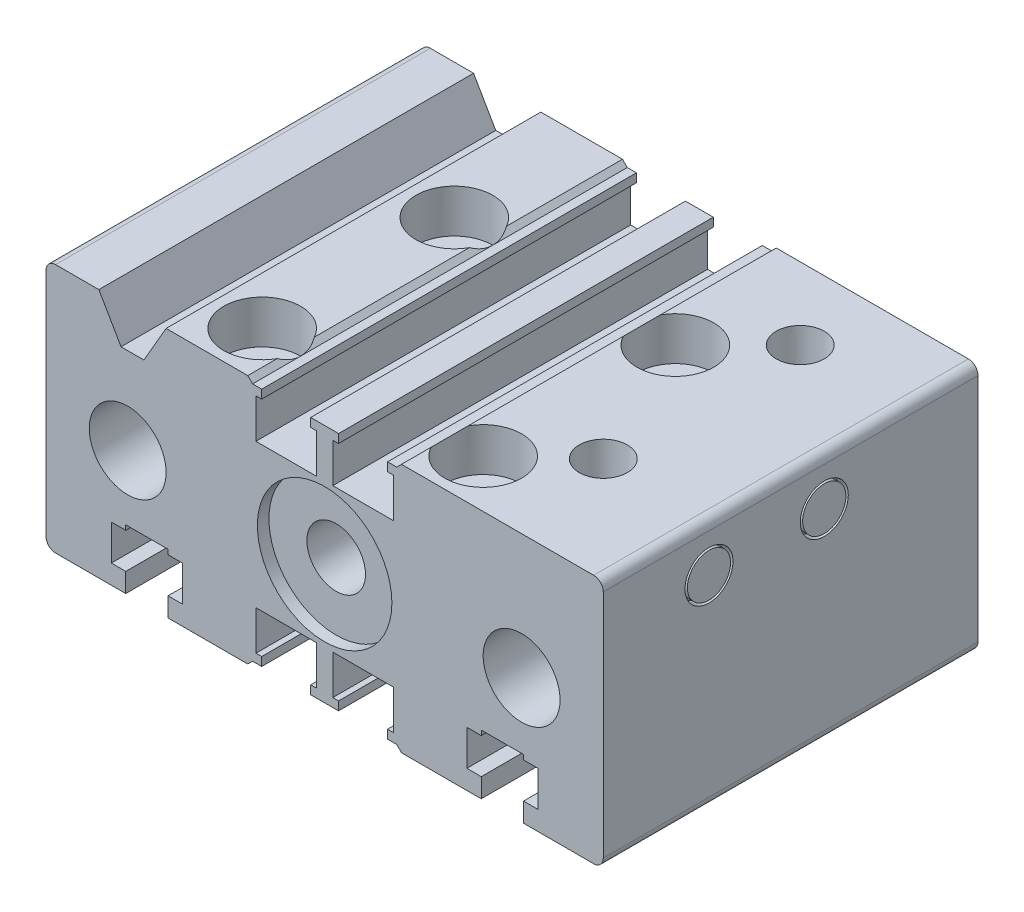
SolidWorks part; units mm, degrees
ref_plane "Plane1" through (0, 0, 0) normal (0, 0, 1) x (1, 0, 0)
ref_plane "Plane2" through (0, 0, 0) normal (0, 1, 0) x (1, 0, 0)
ref_plane "Plane3" through (0, 0, 0) normal (1, 0, 0) x (0, 0, -1)
sketch "Sketch1" plane through (0, 0, 0) normal (0, 0, 1) x (1, 0, 0)
  line L0 (0, 0) -> (0, 30.5092) construction
  line L1 (0, 0) -> (36.9322, 0) construction
  line L3 (-29, 13) -> (29, 13)
  line L4 (-29, 13) -> (-29, -13)
  line L5 (-29, -13) -> (29, -13)
  line L6 (29, 13) -> (29, -13)
  dimension "D1" = 58
  dimension "J" = 13
  dimension "K" = 13
extrude "Base-Extrude" add sketch "Sketch1" along normal up to surface and the other way up to surface
ref_plane "MidPlane" through (0, 0, 0) normal (0, 1, 0) x (-1, 0, 0)
sketch "Sketch9" plane through (0, 0, 19.5) normal (0, 0, 1) x (1, 0, 0)
  circle A0 centre (0, 0) radius 45.5
  dimension "D1" = 91
extrude "Boss_80_100" add sketch "Sketch9" against normal up to surface (108 mm away)
sketch "Sketch10" plane through (0, 0, 54) normal (0, 0, 1) x (1, 0, 0)
  line L0 (76, 35) -> (43.0726, 35)
  line L1 (40.5478, -37.8963) -> (51, -56)
  line L2 (-40.5478, -37.8963) -> (-51, -56)
  line L3 (120, 45) -> (32.4846, 45) construction
  line L4 (0, -20) -> (0, 0) construction
  line L5 (-43.0726, 35) -> (-92.2265, 35)
  line L6 (-32.4846, 45) -> (-120, 45) construction
  line L7 (76, 45) -> (32.4846, 45)
  line L8 (-32.4846, 45) -> (-98, 45)
  line L9 (-51, -56) -> (51, -56)
  line L10 (-120, -56) -> (120, -56) construction
  line L11 (-98, 45) -> (-92.2265, 35)
  line L12 (76, 35) -> (76, 45)
  arc A0 (43.0726, 35) -> (32.4846, 45) centre (0, 0) ccw
  arc A2 (32.4846, 45) -> (-32.4846, 45) centre (0, 0) ccw construction
  arc A3 (-40.5478, -37.8963) -> (40.5478, -37.8963) centre (0, 0) ccw
  arc A4 (-32.4846, 45) -> (-43.0726, 35) centre (0, 0) ccw
  point P11 (0, 60)
  dimension "D3" = 84
  dimension "D1" = 61
  dimension "D2" = 85
  dimension "D4" = 30
  dimension "D6" = 30
  dimension "D7" = 10
extrude "Cut-Extrude1" cut sketch "Sketch10" against normal through all
sketch "Sketch12"
  line L0 (0, 0) -> (0, 89.8309) construction
  line L1 (-92.2265, 35) -> (-43.0726, 35) construction
  line L3 (-49.1625, 35) -> (-43.0726, 35)
  arc A0 (0, 55.5) -> (-49.1625, 35) centre (0, -13.7) ccw
  arc A1 (43.0726, 35) -> (-43.0726, 35) centre (0, 0) ccw construction
  arc A2 (0, 55.5) -> (-43.0726, 35) centre (0, 0) ccw
  point P0 (0, 13.7)
  point P1 (0, -13.7)
  point P10 (0, 0)
  dimension "D3" = 138.4
  dimension "D1" = 13.7
  dimension "D2" = 13.7
fillet "Fillet1" radius 1 4 edges at (-29, -13, 0) (29, -13, 0) (29, 13, 0) (-29, 13, 0)
extrude "T-Grooves" cut sketch "Sketch5" against normal through all
sketch "Sketch5" plane through (0, 0, 19.5) normal (0, 0, 1) x (1, 0, 0)
  line L0 (-18.5, -24) -> (-18.5, -8.6831) construction
  line L1 (-29, -13) -> (29, -13) construction
  line L2 (-20.7, -13) -> (-20.7, -11)
  line L3 (-16.3, -13) -> (-16.3, -11)
  line L4 (-20.7, -11) -> (-22.2, -11)
  line L5 (-16.3, -11) -> (-14.8, -11)
  line L6 (-22.2, -11) -> (-22.2, -7.3)
  line L7 (-14.8, -11) -> (-14.8, -7.3)
  line L8 (-22.2, -7.3) -> (-20.7, -7.3)
  line L9 (-14.8, -7.3) -> (-16.3, -7.3)
  line L10 (-20.7, -7.3) -> (-20.7, -6.8)
  line L11 (-16.3, -7.3) -> (-16.3, -6.8)
  line L12 (-20.7, -6.8) -> (-16.3, -6.8)
  line L13 (0, 0) -> (0, -16.4707) construction
  line L14 (20.7, -6.8) -> (16.3, -6.8)
  line L16 (16.3, -7.3) -> (16.3, -6.8)
  line L17 (20.7, -7.3) -> (20.7, -6.8)
  line L18 (14.8, -7.3) -> (16.3, -7.3)
  line L19 (22.2, -7.3) -> (20.7, -7.3)
  line L20 (14.8, -11) -> (14.8, -7.3)
  line L21 (22.2, -11) -> (22.2, -7.3)
  line L22 (16.3, -11) -> (14.8, -11)
  line L23 (20.7, -11) -> (22.2, -11)
  line L24 (16.3, -13) -> (16.3, -11)
  line L25 (20.7, -13) -> (20.7, -11)
  line L26 (18.5, -11.9621) -> (18.5, -15.8945) construction
  line L27 (16.3, -13) -> (20.7, -13)
  line L28 (-20.7, -13) -> (-16.3, -13)
  dimension "D1" = 4.4
  dimension "D2" = 0.5
  dimension "D3" = 7.4
  dimension "D4" = 3.7
  dimension "D5" = 2
  dimension "D6" = 37
extrude "Boss-Extrude1" add sketch "Sketch12" along normal up to surface (108 mm away)
mirror "Boss-Extrude1 Mirror" about plane through (0, 0, 0) normal (1, 0, 0)
sketch "Sketch11" plane through (0, 0, 19.5) normal (0, 0, 1) x (1, 0, 0)
  line L0 (0, 0) -> (-46.0532, 79.7665) construction
  line L1 (0, 0) -> (0, 89.8309) construction
  line L2 (-22.8069, 22.5028) -> (-45.6801, 62.1202) construction
  line L3 (0, 0) -> (-14.1941, -8.1949) construction
  line L4 (-30.6815, 26.742) -> (-35.6815, 35.4022)
  line L5 (-22.5409, 31.442) -> (-27.5409, 40.1022)
  line L7 (-27.5409, 40.1022) -> (-35.6815, 35.4022)
  line L14 (-30.6815, 26.742) -> (-26.6112, 29.092)
  line L15 (-22.5409, 31.442) -> (-26.6112, 29.092)
  dimension "D1" = 30
  dimension "D2" = 8.5
  dimension "D3" = 9.4
  dimension "D7" = 38.5
  dimension "D8" = 10
extrude "SwitchGrooveBoss" add sketch "Sketch11" along normal up to surface (108 mm away)
sketch "Sketch13" plane through (0, 0, 54) normal (0, 0, 1) x (1, 0, 0)
  line L0 (-37.4612, 47.8847) -> (-33.1368, 40.3947) construction
  line L1 (-33.3909, 50.2347) -> (-41.5315, 45.5347) construction
  line L2 (-31.925, 47.6957) -> (-33.3909, 50.2347) construction
  line L3 (-41.5315, 45.5347) -> (-39.9533, 42.8011) construction
  line L4 (-39.5392, 45.1839) -> (-37.6892, 41.9796)
  line L5 (-34.0832, 48.3339) -> (-32.2332, 45.1296)
  line L6 (-37.6892, 41.9796) -> (-34.9612, 43.5546)
  line L7 (-32.2332, 45.1296) -> (-34.9612, 43.5546)
  line L8 (-39.5392, 45.1839) -> (-38.9763, 45.5089)
  line L9 (-34.0832, 48.3339) -> (-34.6462, 48.0089)
  line L10 (-38.9763, 45.5089) -> (-39.6263, 46.6347)
  line L11 (-34.6462, 48.0089) -> (-35.2962, 49.1347)
  line L12 (-39.6263, 46.6347) -> (-35.2962, 49.1347)
  dimension "D1" = 5
  dimension "D2" = 6.3
  dimension "D3" = 5.1
  dimension "D4" = 4.1
extrude "SwitchGrooveCut" cut sketch "Sketch13" against normal through all
mirror "SwitchGrooveMirror1" about plane through (0, 0, 0) normal (1, 0, 0)
mirror "SwitchGrooveMirror2" about plane through (0, 0, 0) normal (0, 1, 0)
sketch "Sketch6" plane through (0, 0, 19.5) normal (0, 0, 1) x (1, 0, 0)
  line L0 (-4, -13) -> (-4, -9.0947) construction
  line L1 (-16.3, -13) -> (16.3, -13) construction
  line L2 (-6.55, -13) -> (-6.55, -11.6)
  line L3 (-1.45, -13) -> (-1.45, -11.6)
  line L4 (-6.55, -11.6) -> (-7.15, -11.6)
  line L5 (-1.45, -11.6) -> (-0.85, -11.6)
  line L6 (-7.15, -11.6) -> (-7.15, -7.5)
  line L7 (-0.85, -11.6) -> (-0.85, -7.5)
  line L8 (-7.15, -7.5) -> (-0.85, -7.5)
  line L9 (0, 0) -> (0, -15.1958) construction
  line L10 (7.15, -7.5) -> (0.85, -7.5)
  line L11 (0.85, -11.6) -> (0.85, -7.5)
  line L12 (7.15, -11.6) -> (7.15, -7.5)
  line L13 (1.45, -11.6) -> (0.85, -11.6)
  line L14 (6.55, -11.6) -> (7.15, -11.6)
  line L15 (1.45, -13) -> (1.45, -11.6)
  line L16 (6.55, -13) -> (6.55, -11.6)
  line L17 (4, -7.5) -> (4, -15.1958) construction
  line L18 (-6.55, -13) -> (-1.45, -13)
  line L19 (1.45, -13) -> (6.55, -13)
  line L30 (0, 0) -> (0, 17.045) construction
  point P13 (-4, -7.5)
  point P24 (4, -7.5)
  dimension "D4" = 5.5
  dimension "d2" = 6.3
  dimension "D3" = 4.1
  dimension "D6" = 5.1
  dimension "D5" = 8
extrude "SwitchGrooves" cut sketch "Sketch6" against normal through all
mirror "TopSwitchGrooves" about plane through (0, 0, 0) normal (0, 1, 0) of "SwitchGrooves"
sketch "Sketch7" plane through (0, 0, -19.5) normal (0, 0, 1) x (1, 0, 0)
  line L0 (0, 0) -> (0, 19.7119) construction
  line L1 (0, 0) -> (17.3251, 0) construction
  circle A0 centre (25, 9) radius 2
  circle A1 centre (25, -9) radius 2
  circle A2 centre (-25, -9) radius 2
  circle A3 centre (-25, 9) radius 2
  dimension "D1" = 4
  dimension "D2" = 50
  dimension "D3" = 18
extrude "4-thruHoles" cut sketch "Sketch7" along normal blind 10
sketch "Sketch8" plane through (0, 0, 19.5) normal (0, 0, 1) x (1, 0, 0)
  line L0 (0, 0) -> (0, 20.2881) construction
  circle A0 centre (20.5, 0) radius 4
  circle A1 centre (-20.5, 0) radius 4
  dimension "D1" = 8
  dimension "D2" = 41
extrude "GuideRodThruBores" cut sketch "Sketch8" against normal through all
sketch "Sketch2" plane through (0, 0, 0) normal (0, 0, 1) x (1, 0, 0)
  circle A0 centre (0, 0) radius 6
  dimension "D1" = 12
extrude "StrokeChamber" cut sketch "Sketch2" along normal up to surface and the other way up to surface
sketch "Sketch3" plane through (0, 0, 19.5) normal (0, 0, 1) x (1, 0, 0)
  circle A0 centre (0, 0) radius 7
  dimension "D1" = 14
extrude "FrontDetail" cut sketch "Sketch3" against normal blind 1.2
mirror "Mirror1" about plane through (0, 0, 0) normal (0, 0, 1) of "FrontDetail"
sketch "Sketch4" plane through (0, 0, 18.3) normal (0, 0, 1) x (1, 0, 0)
  circle A0 centre (0, 0) radius 3.05
  dimension "D1" = 6.1
extrude "RodThruBore" cut sketch "Sketch4" against normal up to surface (18.3 mm away)
sketch "Sketch14" plane through (0, 13, 0) normal (0, 1, 0) x (-1, 0, 0)
  line L0 (0, 0) -> (0, -116.3953) construction
  line L1 (-28, 19.5) -> (-6.55, 19.5) construction
  line L2 (-6.55, -19.5) -> (-28, -19.5) construction
  circle A0 centre (-18, 8.5) radius 2.5
  circle A1 centre (-18, -12) radius 2.5
  dimension "D2" = 18
  dimension "D3" = 7.5
  dimension "D5" = 11
extrude "Ports" cut sketch "Sketch14" against normal blind 5 draft 3
ref_plane "ThruHole&CborePlane" through (0, 13, 0) normal (0, 1, 0) x (-1, 0, 0)
sketch "Sketch15" plane through (0, 13, 0) normal (0, 1, 0) x (-1, 0, 0)
  line L0 (0, 0) -> (0, -121.9997) construction
  line L1 (0, 0) -> (50.8535, 0) construction
  line L2 (6.55, 19.5) -> (28, 19.5) construction
  line L7 (50, -5.5) -> (-50, -5.5) construction
  circle A0 centre (-11.5, -5.5) radius 2.15
  circle A1 centre (11.5, -5.5) radius 2.15
  circle A2 centre (11.5, 14.5) radius 2.15
  circle A3 centre (-11.5, 14.5) radius 2.15
  dimension "D1" = 5
  dimension "D3" = 4.3
  dimension "D4" = 4.3
extrude "ThruHoles" cut sketch "Sketch15" against normal through all
sketch "Sketch16" plane through (0, 13, 0) normal (0, 1, 0) x (-1, 0, 0)
  line L0 (0, 0) -> (0, -19.2349) construction
  line L1 (0, 0) -> (-15.9345, 0) construction
  circle A0 centre (-11.5, -5.5) radius 4
  circle A1 centre (11.5, -5.5) radius 4
  circle A2 centre (11.5, 14.5) radius 4
  circle A3 centre (-11.5, 14.5) radius 4
  circle A6 centre (11.5, 14.5) radius 2.15 construction
  dimension "D1" = 8
extrude "Cbores" cut sketch "Sketch16" against normal blind 4.5
sketch "Sketch17" plane through (0, -13, 0) normal (0, -1, 0) x (1, 0, 0)
  line L0 (0, -2.3725) -> (0, -23.1343) construction
  line L1 (50, 4.5) -> (-50, 4.5) construction
  circle A0 centre (11.5, 4.5) radius 1.5
  circle A1 centre (-11.5, 4.5) radius 1.5
  dimension "D1" = 3
  dimension "D2" = 23
extrude "BlindHolesBottom" cut sketch "Sketch17" against normal blind 4
sketch "Sketch18" plane through (29, 0, 0) normal (1, 0, 0) x (0, 0, -1)
  line L0 (3.5, 50) -> (3.5, -50) construction
  line L1 (0, 0) -> (-65, 0) construction
  line L2 (-7.5, 0) -> (7.5, 0) construction
  line L3 (-19.5, -12) -> (-19.5, 12) construction
  circle A0 centre (-8.5, 8) radius 2.5
  circle A1 centre (3.5, 8) radius 2.5
  dimension "D1" = 11
  dimension "D2" = 8
extrude "PlugCut" cut sketch "Sketch18" against normal blind 1
sketch "Sketch19" plane through (28, 0, 0) normal (1, 0, 0) x (0, 0, -1)
  circle A0 centre (-8.5, 8) radius 2.25
  circle A1 centre (-8.5, 8) radius 2.5 construction
  circle A2 centre (3.5, 8) radius 2.25
  circle A3 centre (3.5, 8) radius 2.5 construction
  dimension "PLUG" = 4.5
extrude "Plug" add sketch "Sketch19" along normal up to surface (1 mm away)
sketch "Sketch20" plane through (0, 0, 19.5) normal (0, 0, 1) x (1, 0, 0)
  line L0 (0, 0) -> (0, 22.3755) construction
  line L1 (8, 13) -> (7.5, 12.5)
  line L3 (-8, 13) -> (-7.5, 12.5)
  line L4 (-7.5, 12.5) -> (7.5, 12.5)
  line L5 (-8, 13) -> (8, 13)
  line L6 (50, 13) -> (-50, 13) construction
  point P10 (0, 11.1878)
  dimension "D1" = 45
  dimension "D2" = 16
  dimension "D3" = 0.5
extrude "TopRelief" cut sketch "Sketch20" against normal through all
sketch "Sketch21" plane through (0, 0, 19.5) normal (0, 0, 1) x (1, 0, 0)
  line L0 (0, 0) -> (0, 32.3636) construction
  line L1 (-7.2, 13) -> (-7.2, 8)
  line L2 (50, 13) -> (-50, 13) construction
  line L3 (7.2, 13) -> (7.2, 8)
  line L4 (-7.2, 8) -> (7.2, 8)
  line L5 (-7.2, 13) -> (7.2, 13)
  point P10 (0, 8)
  point P11 (0, 13)
  dimension "D1" = 5
  dimension "D2" = 14.4
extrude "CenterRelief" cut sketch "Sketch21" against normal through all
mirror "Mirror2" about plane through (0, 0, 0) normal (0, 1, 0)
sketch "Sketch22" plane through (0, 0, 19.5) normal (0, 0, 1) x (1, 0, 0)
  line L0 (-20, 32.5256) -> (-20, 17.3864) construction
  line L1 (-23.5, 13) -> (-21.1906, 9)
  line L2 (-16.5, 13) -> (-18.8094, 9)
  line L3 (-21.1906, 9) -> (-18.8094, 9)
  line L4 (-23.5, 13) -> (-16.5, 13)
  line L5 (0, 0) -> (0, 37.2566) construction
  line L6 (50, 13) -> (-50, 13) construction
  point P7 (-20, 9)
  dimension "D1" = 30
  dimension "D2" = 16.5
  dimension "D3" = 23.5
  dimension "D4" = 4
extrude "VCut" cut sketch "Sketch22" against normal through all
sketch "Sketch23" plane through (-19.2452, 11.1112, 0) normal (-0.866, 0.5, 0) x (0, 0, 1)
  line L0 (29, -3.8756) -> (29, -28.1244) construction
  line L1 (-29, 4.4904) -> (29, 4.4904) construction
  line L2 (-29, -0.7058) -> (-29, 4.4904) construction
  circle A0 centre (4.5, 2.9904) radius 1.75
  circle A1 centre (-10.5, 2.9904) radius 1.75
  point P9 (0, 0)
  dimension "D1" = 3.5
  dimension "D2" = 3.5
  dimension "D5" = 1.5
  dimension "D4" = 18.5
  dimension "D3" = 24.5
extrude "CushionValve16_25" cut sketch "Sketch23" against normal blind 4
sketch "Sketch28" plane through (-15.7811, 9.1112, 0) normal (-0.866, 0.5, 0) x (0, 0, 1)
  circle A0 centre (4.5, 2.9904) radius 1.25
  circle A1 centre (-10.5, 2.9904) radius 1.25
  dimension "D1" = 2.5
  dimension "D2" = 2.5
extrude "CushionValve16_25X" add sketch "Sketch28" along normal up to surface (4 mm away)
sketch "Sketch24" plane through (0, 39, 0) normal (0, 1, 0) x (-1, 0, 0)
  line L0 (67, 212) -> (80, 212) construction
  line L1 (80, -212) -> (67, -212) construction
  circle A0 centre (27, -187) radius 2
  circle A1 centre (27, 182) radius 2
  dimension "D1" = 4
  dimension "D2" = 4
  dimension "D3" = 24.5
  dimension "D5" = 24.55
  dimension "D4" = 18.5
extrude "CushionValve32_63" cut sketch "Sketch24" against normal blind 4
sketch "Sketch27" plane through (0, 35, 0) normal (0, 1, 0) x (-1, 0, 0)
  circle A0 centre (27, 182) radius 1.5
  circle A1 centre (27, -187) radius 1.5
  dimension "D1" = 3
  dimension "D2" = 3
extrude "CushionValve32_63X" add sketch "Sketch27" along normal up to surface (4 mm away)
ref_plane "80-100CushionPlane" through (0, 50.1, 0) normal (0, 1, 0) x (-1, 0, 0)
sketch "Sketch25" plane through (0, 50.1, 0) normal (0, 1, 0) x (-1, 0, 0)
  line L0 (0, 27.5) -> (0, -27.5) construction
  line L1 (-119, 54) -> (-76, 54) construction
  line L2 (-76, -54) -> (-119, -54) construction
  circle A0 centre (0, -26.6) radius 3.5
  circle A1 centre (0, 26.2) radius 3.5
  dimension "D1" = 7
  dimension "D2" = 7
  dimension "D4" = 18.5
  dimension "D3" = 24.5
extrude "CushionValve80_100" cut sketch "Sketch25" along normal through all
sketch "Sketch26" plane through (0, 50.1, 0) normal (0, 1, 0) x (-1, 0, 0)
  circle A1 centre (0, -26.6) radius 3
  circle A2 centre (0, 26.2) radius 3
  dimension "D1" = 6
  dimension "D2" = 6
extrude "CushionValve80_100X" add sketch "Sketch26" along normal blind 5
mirror "Mirror4" about plane through (0, 0, 0) normal (0, 1, 0) of "TopRelief"
